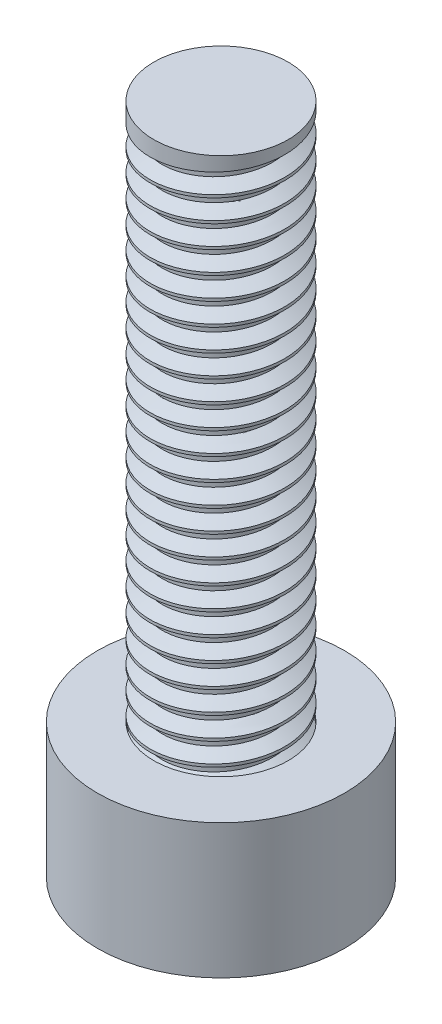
SolidWorks part; units mm, degrees
ref_plane "Front Plane" through (0, 0, 0) normal (0, 0, 1) x (1, 0, 0)
ref_plane "Top Plane" through (0, 0, 0) normal (0, 1, 0) x (1, 0, 0)
ref_plane "Right Plane" through (0, 0, 0) normal (1, 0, 0) x (0, 0, -1)
sketch "Sketch1" plane through (0, 0, 0) normal (0, 1, 0) x (1, 0, 0)
  circle A0 centre (0, 0) radius 2.7559
  dimension "D1" = 5.5118
extrude "Boss-Extrude1" add sketch "Sketch1" along normal blind 3
sketch "Sketch2" plane through (0, 3, 0) normal (0, 1, 0) x (1, 0, 0)
  circle A0 centre (0, 0) radius 1.5
  dimension "D1" = 3
extrude "Boss-Extrude2" add sketch "Sketch2" along normal blind 12
sketch "Sketch3" plane through (0, 0, 0) normal (0, -1, 0) x (1, 0, 0)
  line L1 (0.7186, 1.2446) -> (-0.7186, 1.2446)
  line L2 (-0.7186, 1.2446) -> (-1.4371, 0)
  line L3 (-1.4371, 0) -> (-0.7186, -1.2446)
  line L4 (-0.7186, -1.2446) -> (0.7186, -1.2446)
  line L5 (0.7186, -1.2446) -> (1.4371, 0)
  line L6 (1.4371, 0) -> (0.7186, 1.2446)
  circle A0 centre (0, 0) radius 1.2446 construction
  dimension "D1" = 2.4892
extrude "Cut-Extrude1" cut sketch "Sketch3" against normal blind 2
thread "Thread1" pitch 0.5 start angle 0, offset 0, length 0, pitch 0.5, diameter 3
ref_plane "Plane1" through (-1.5, 15, 0) normal (0, 0, 1) x (-1, 0, 0)
sketch "Thread Profile1" plane through (-1.5, 15, 0) normal (0, 0, 1) x (-1, 0, 0)
  line L0 (0, 0) -> (0, 0.5) construction
  line L11 (0, 0) -> (0, 0.4375)
  line L12 (0, 0.4375) -> (-0.2706, 0.2812)
  line L13 (-0.2706, 0.2812) -> (-0.2706, 0.1562)
  line L15 (-0.2706, 0.1562) -> (0, 0)
  line L17 (-0.2706, 0.2187) -> (0, 0.2187) construction
  point P2 (0, 0)
  dimension "Pitch" = 0.5
  dimension "Profile_Angle" = 60
  dimension "Profile_Land" = 0.125
  dimension "Profile_Height" = 0.2706
